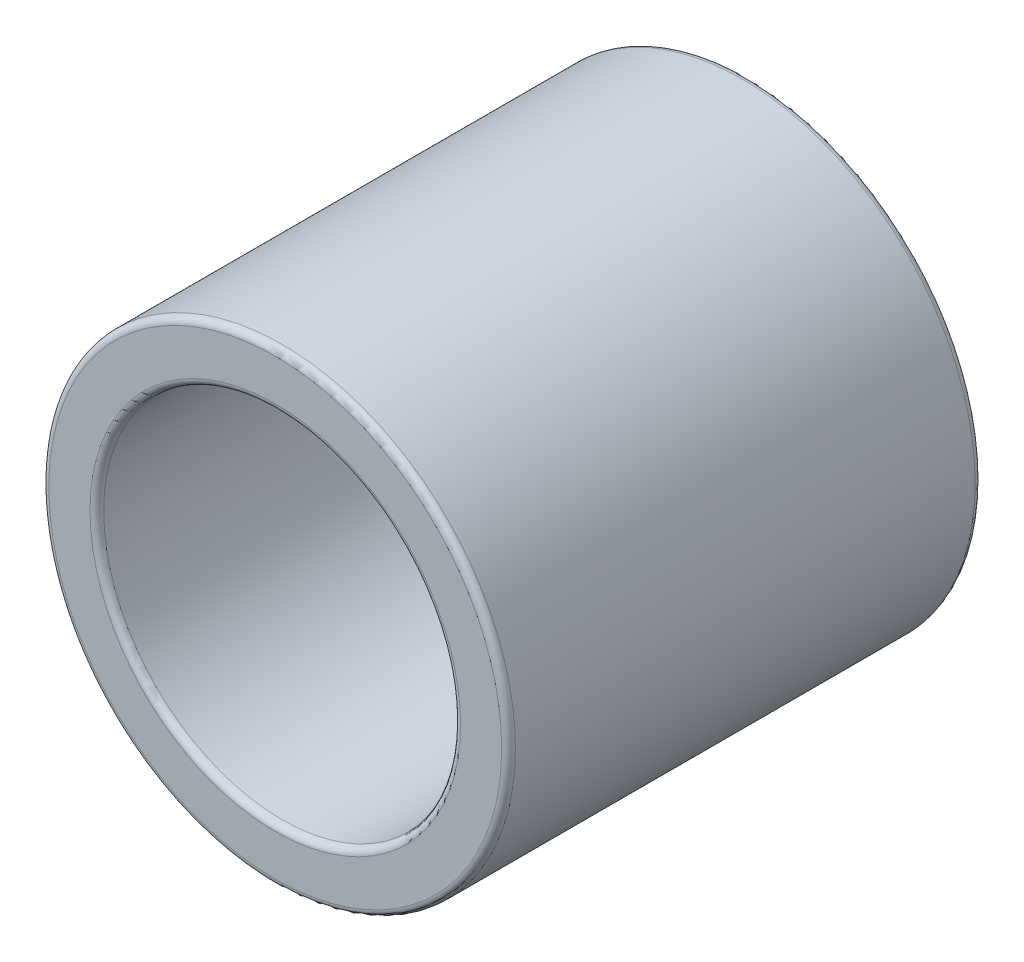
SolidWorks part; units mm, degrees
ref_plane "Face" through (0, 0, 0) normal (0, 0, 1) x (1, 0, 0)
ref_plane "Dessus" through (0, 0, 0) normal (0, 1, 0) x (1, 0, 0)
ref_plane "Droite" through (0, 0, 0) normal (1, 0, 0) x (0, 0, -1)
sketch "Esquisse1" plane through (0, 0, 0) normal (0, 0, 1) x (1, 0, 0)
  circle A0 centre (0, 0) radius 17
  circle A1 centre (0, 0) radius 13
  dimension "D1" = 26
  dimension "D2" = 34
extrude "Extrusion1" add sketch "Esquisse1" along normal blind 34.5
fillet "Congé1" radius 0.5
